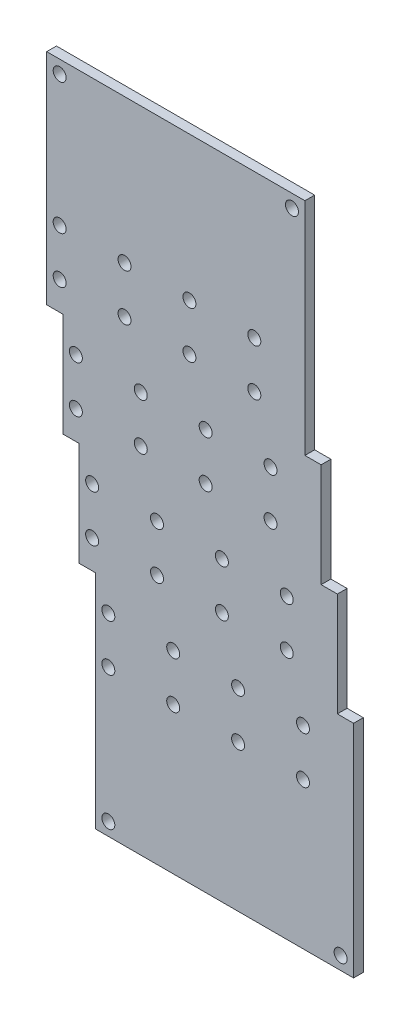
SolidWorks part; units mm, degrees
ref_plane "Alzado" through (0, 0, 0) normal (0, 0, 1) x (1, 0, 0)
ref_plane "Planta" through (0, 0, 0) normal (0, 1, 0) x (1, 0, 0)
ref_plane "Vista lateral" through (0, 0, 0) normal (1, 0, 0) x (0, 0, -1)
sketch "Croquis1" plane through (0, 0, 0) normal (0, 0, 1) x (1, 0, 0)
  line L0 (0, 0) -> (0, -33.8)
  line L1 (0, -33.8) -> (2.5, -33.8)
  line L2 (2.5, -33.8) -> (2.5, -49.8)
  line L3 (2.5, -49.8) -> (5, -49.8)
  line L4 (5, -49.8) -> (5, -65.8)
  line L5 (5, -65.8) -> (7.5, -65.8)
  line L6 (7.5, -65.8) -> (7.5, -100)
  line L7 (0, 0) -> (39.8, 0)
  line L8 (39.8, 0) -> (39.8, -34)
  line L9 (39.8, -34) -> (42.3, -34)
  line L10 (42.3, -34) -> (42.3, -50)
  line L11 (42.3, -50) -> (44.8, -50)
  line L12 (44.8, -50) -> (44.8, -66)
  line L13 (44.8, -66) -> (47.3, -66)
  line L14 (47.3, -66) -> (47.3, -100)
  line L15 (47.3, -100) -> (7.5, -100)
  dimension "D1" = 33.8
  dimension "D2" = 2.5
  dimension "D3" = 16
  dimension "D4" = 2.5
  dimension "D5" = 16
  dimension "D6" = 2.5
  dimension "D7" = 100
  dimension "D8" = 39.8
  dimension "D9" = 2.5
  dimension "D10" = 2.5
  dimension "D11" = 2.5
  dimension "D12" = 34
  dimension "D13" = 16
  dimension "D14" = 16
extrude "Saliente-Extruir1" add sketch "Croquis1" along normal blind 1.5
sketch "Croquis2" plane through (0, 0, 1.5) normal (0, 0, 1) x (1, 0, 0)
  line L0 (0, 0) -> (0, -33.8) construction
  line L1 (0, -33.8) -> (2.5, -33.8) construction
  line L2 (2.5, -33.8) -> (2.5, -49.8) construction
  line L3 (2.5, -49.8) -> (5, -49.8) construction
  line L4 (5, -49.8) -> (5, -65.8) construction
  line L5 (5, -65.8) -> (7.5, -65.8) construction
  line L6 (7.5, -65.8) -> (7.5, -100) construction
  circle A0 centre (2, -22.2) radius 1
  circle A1 centre (2, -29.4) radius 1
  circle A2 centre (4.5, -38.2) radius 1
  circle A3 centre (4.5, -45.4) radius 1
  circle A4 centre (7, -54.2) radius 1
  circle A5 centre (7, -61.4) radius 1
  circle A6 centre (9.5, -70.2) radius 1
  circle A7 centre (9.5, -77.4) radius 1
  circle A8 centre (12, -22.2) radius 1
  circle A9 centre (12, -29.4) radius 1
  circle A10 centre (14.5, -38.2) radius 1
  circle A11 centre (14.5, -45.4) radius 1
  circle A12 centre (17, -54.2) radius 1
  circle A13 centre (17, -61.4) radius 1
  circle A14 centre (19.5, -70.2) radius 1
  circle A15 centre (19.5, -77.4) radius 1
  circle A16 centre (22, -22.2) radius 1
  circle A17 centre (22, -29.4) radius 1
  circle A18 centre (24.5, -38.2) radius 1
  circle A19 centre (24.5, -45.4) radius 1
  circle A20 centre (27, -54.2) radius 1
  circle A21 centre (27, -61.4) radius 1
  circle A22 centre (29.5, -70.2) radius 1
  circle A23 centre (29.5, -77.4) radius 1
  circle A24 centre (32, -22.2) radius 1
  circle A25 centre (32, -29.4) radius 1
  circle A26 centre (34.5, -38.2) radius 1
  circle A27 centre (34.5, -45.4) radius 1
  circle A28 centre (37, -54.2) radius 1
  circle A29 centre (37, -61.4) radius 1
  circle A30 centre (39.5, -70.2) radius 1
  circle A31 centre (39.5, -77.4) radius 1
  point P29 (6.25, -65.8)
  dimension "D1" = 2
  dimension "D2" = 2
  dimension "D5" = 2
  dimension "D6" = 2
  dimension "D7" = 2
  dimension "D8" = 7.2
  dimension "D9" = 4.4
  dimension "D10" = 2
  dimension "D11" = 2
  dimension "D12" = 2
  dimension "D13" = 2
  dimension "D14" = 7.2
  dimension "D15" = 2
  dimension "D16" = 4.4
  dimension "D17" = 8.8
  dimension "D18" = 2
  dimension "D19" = 2
  dimension "D20" = 7.2
  dimension "D3" = 7.2
  dimension "D4" = 4.4
  dimension "D21" = 2
  dimension "D22" = 4
extrude "Cortar-Extruir1" cut sketch "Croquis2" against normal up to next (1.5 mm away)
sketch "Croquis3" plane through (0, 0, 1.5) normal (0, 0, 1) x (1, 0, 0)
  line L0 (0, 0) -> (0, -33.8) construction
  line L1 (39.8, 0) -> (0, 0) construction
  line L2 (39.8, -34) -> (39.8, 0) construction
  line L3 (7.5, -65.8) -> (7.5, -100) construction
  line L4 (7.5, -100) -> (47.3, -100) construction
  line L5 (47.3, -100) -> (47.3, -66) construction
  circle A0 centre (2, -2) radius 1
  circle A1 centre (37.8, -2) radius 1
  circle A2 centre (9.5, -98) radius 1
  circle A3 centre (45.3, -98) radius 1
  dimension "D2" = 2
  dimension "D3" = 2
  dimension "D4" = 2
  dimension "D5" = 2
  dimension "D6" = 2
  dimension "D7" = 2
  dimension "D8" = 2
  dimension "D9" = 2
  dimension "D10" = 2
  dimension "D11" = 2
  dimension "D12" = 2
  dimension "D1" = 2
extrude "Cortar-Extruir2" cut sketch "Croquis3" against normal up to next
